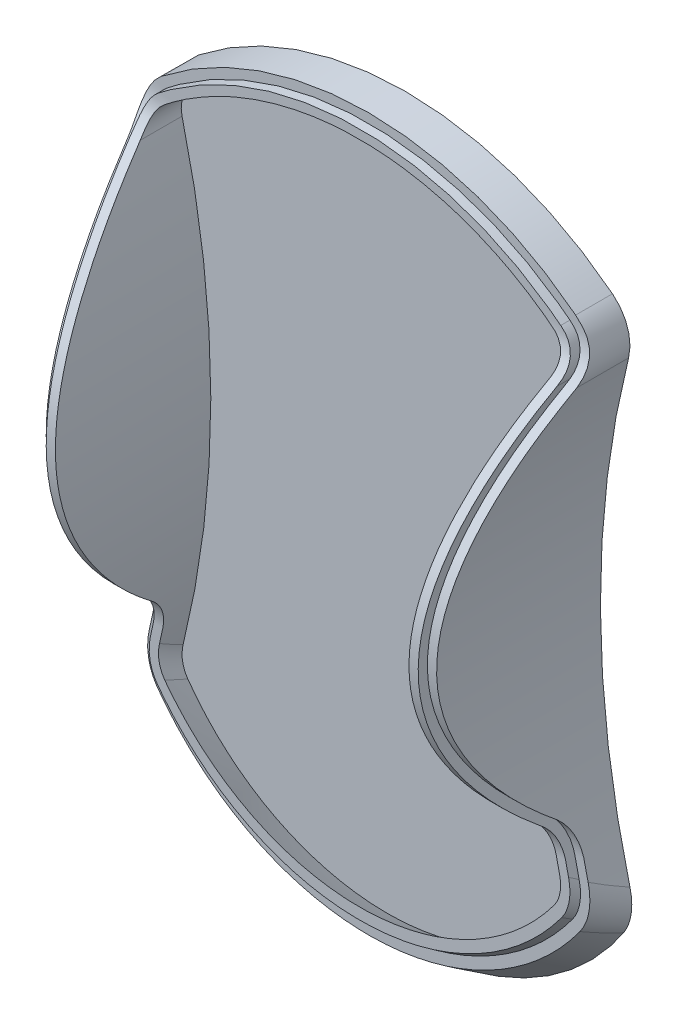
SolidWorks part; units mm, degrees
ref_plane "Płaszczyzna przednia" through (0, 0, 0) normal (0, 0, 1) x (1, 0, 0)
ref_plane "Płaszczyzna górna" through (0, 0, 0) normal (0, 1, 0) x (1, 0, 0)
ref_plane "Płaszczyzna prawa" through (0, 0, 0) normal (1, 0, 0) x (0, 0, -1)
body saved out of another part "Zapas-Mysz-Inny podział-1"
